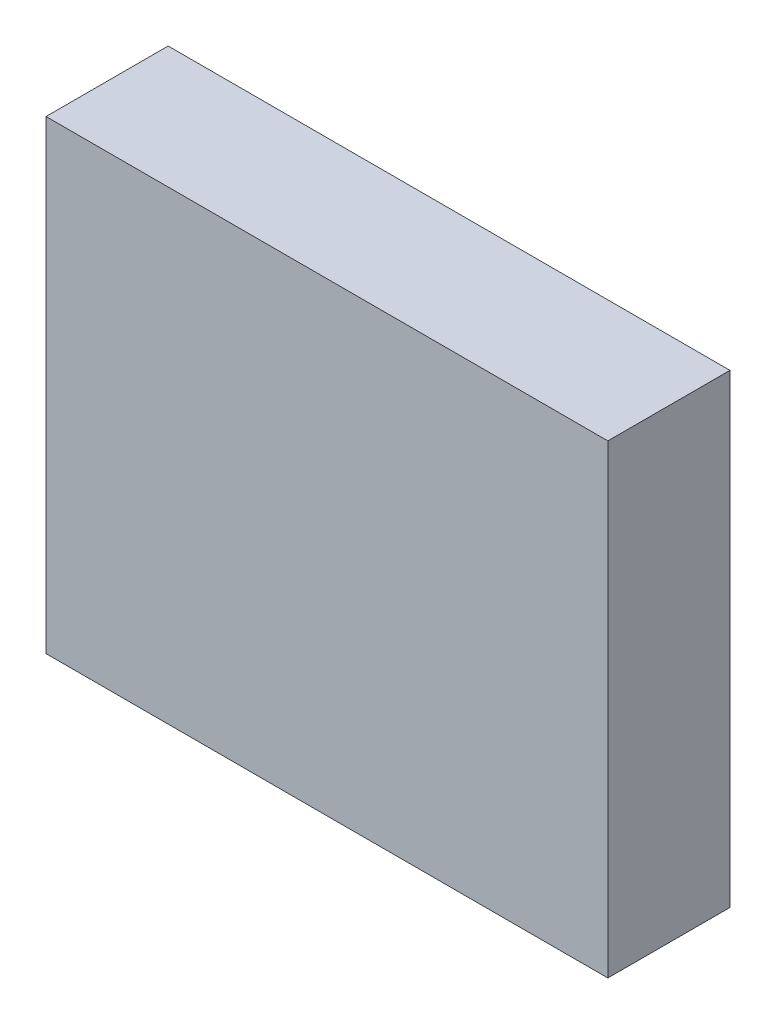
SolidWorks part; units mm, degrees
ref_plane "Ebene vorne" through (0, 0, 0) normal (0, 0, 1) x (1, 0, 0)
ref_plane "Ebene oben" through (0, 0, 0) normal (0, 1, 0) x (1, 0, 0)
ref_plane "Ebene rechts" through (0, 0, 0) normal (1, 0, 0) x (0, 0, -1)
sketch "Sketch1" plane through (0, 0, 0) normal (0, 0, 1) x (1, 0, 0)
  line L1 (0, 0) -> (92.0079, 0)
  line L2 (0, 0) -> (0, 76.1808)
  line L3 (0, 76.1808) -> (92.0079, 76.1808)
  line L4 (92.0079, 0) -> (92.0079, 76.1808)
extrude "Extrude1" add sketch "Sketch1" along normal mid plane 20
